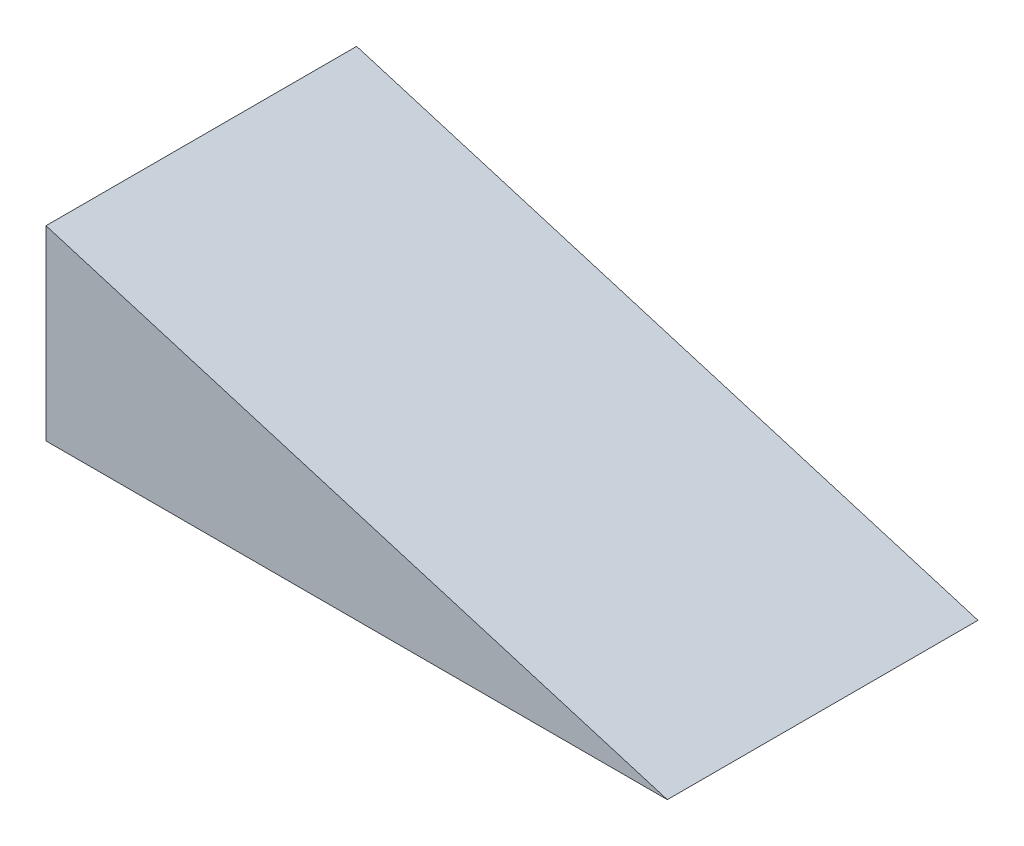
SolidWorks part; units mm, degrees
ref_plane "Front" through (0, 0, 0) normal (0, 0, 1) x (1, 0, 0)
ref_plane "Top" through (0, 0, 0) normal (0, 1, 0) x (1, 0, 0)
ref_plane "Right" through (0, 0, 0) normal (1, 0, 0) x (0, 0, -1)
sketch "Sketch1" plane through (0, 0, 0) normal (0, 0, 1) x (1, 0, 0)
  line L0 (0, 6) -> (0, 0)
  line L1 (0, 0) -> (20, 0)
  line L2 (20, 0) -> (0, 6)
  dimension "D1" = 20
  dimension "D2" = 6
extrude "Extrude1" add sketch "Sketch1" along normal blind 10
sketch "Sketch2" plane through (0, 0, 0) normal (-1, 0, 0) x (0, 0, 1)
  circle A0 centre (5, 3) radius 1.5
extrude "Cut-Extrude1" cut sketch "Sketch2" against normal blind 4
